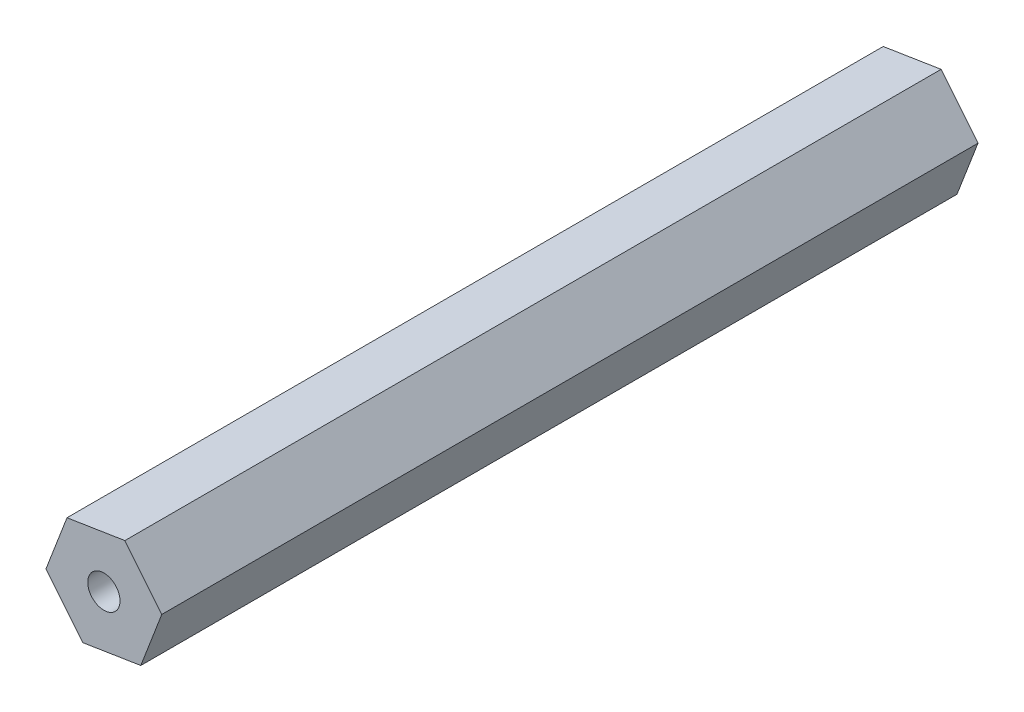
SolidWorks part; units mm, degrees
ref_plane "Front Plane" through (0, 0, 0) normal (0, 0, 1) x (1, 0, 0)
ref_plane "Top Plane" through (0, 0, 0) normal (0, 1, 0) x (1, 0, 0)
ref_plane "Right Plane" through (0, 0, 0) normal (1, 0, 0) x (0, 0, -1)
sketch "Sketch1" plane through (0, 0, 0) normal (0, 0, 1) x (1, 0, 0)
  line L1 (2.6268, 6.8457) -> (-4.6151, 5.6977)
  line L2 (-4.6151, 5.6977) -> (-7.2419, -1.148)
  line L3 (-7.2419, -1.148) -> (-2.6268, -6.8457)
  line L4 (-2.6268, -6.8457) -> (4.6151, -5.6977)
  line L5 (4.6151, -5.6977) -> (7.2419, 1.148)
  line L6 (7.2419, 1.148) -> (2.6268, 6.8457)
  circle A0 centre (0, 0) radius 6.35 construction
  point P10 (0, 0)
  dimension "D1" = 12.7
extrude "Boss-Extrude1" add sketch "Sketch1" along normal blind 102.108
ref_plane "Plane1" through (0, 0, 0) normal (0.7771, 0.6294, 0) x (0, 0, -1)
hole_wizard "Tap Drill for #10-32 Tap2" positions "3DSketch5" profile "Sketch9" hole size "#10-32" standard "ANSI Inch"
sketch3d "3DSketch5"
  line L0 (-4.6151, 5.6977, 102.108) -> (4.6151, -5.6977, 102.108) construction
  line L2 (-7.2419, -1.148, 102.108) -> (7.2419, 1.148, 102.108) construction
  line L3 (-4.6151, 5.6977, 0) -> (4.6151, -5.6977, 0) construction
  line L5 (-7.2419, -1.148, 0) -> (7.2419, 1.148, 0) construction
  point P0 (0, 0, 102.108)
  point P14 (0, 0, 0)
  point P28 (0, 0, 0)
  point P30 (0, 0, 0)
  point P34 (0, 0, 0)
  point P37 (0, 0, 0)
  point P39 (0, 0, 0)
  point P41 (0, 0, 0)
sketch "Sketch9" plane through (0, 0, 102.108) normal (1, 0, 0) x (0, -1, 0)
  line L0 (0, 0) -> (0, 13.9133)
  line L1 (0, 13.9133) -> (2.0193, 12.7)
  line L2 (2.0193, 12.7) -> (2.0193, 0)
  line L5 (2.0193, 0) -> (0, 0)
  line L10 (0, 13.9133) -> (-2.0193, 12.7) construction
  line L11 (0, -6.35) -> (0, 107.95) construction
  dimension "Hole Dia." = 4.0386
  dimension "Hole Depth" = 12.7
  dimension "Drill Angle" = 118
hole_wizard "Tap Drill for #10-32 Tap3" positions "3DSketch6" profile "Sketch8" hole size "#10-32" standard "ANSI Inch"
sketch3d "3DSketch6"
  line L0 (-7.2419, -1.148, 0) -> (7.2419, 1.148, 0) construction
  line L2 (-4.6151, 5.6977, 0) -> (4.6151, -5.6977, 0) construction
  point P0 (0, 0, 0)
sketch "Sketch8" plane through (0, 0, 0) normal (1, 0, 0) x (0, 1, 0)
  line L0 (0, 0) -> (0, 13.9133)
  line L1 (0, 13.9133) -> (2.0193, 12.7)
  line L2 (2.0193, 12.7) -> (2.0193, 0)
  line L5 (2.0193, 0) -> (0, 0)
  line L10 (0, 13.9133) -> (-2.0193, 12.7) construction
  line L11 (0, -6.35) -> (0, 107.95) construction
  dimension "Hole Dia." = 4.0386
  dimension "Hole Depth" = 12.7
  dimension "Drill Angle" = 118
